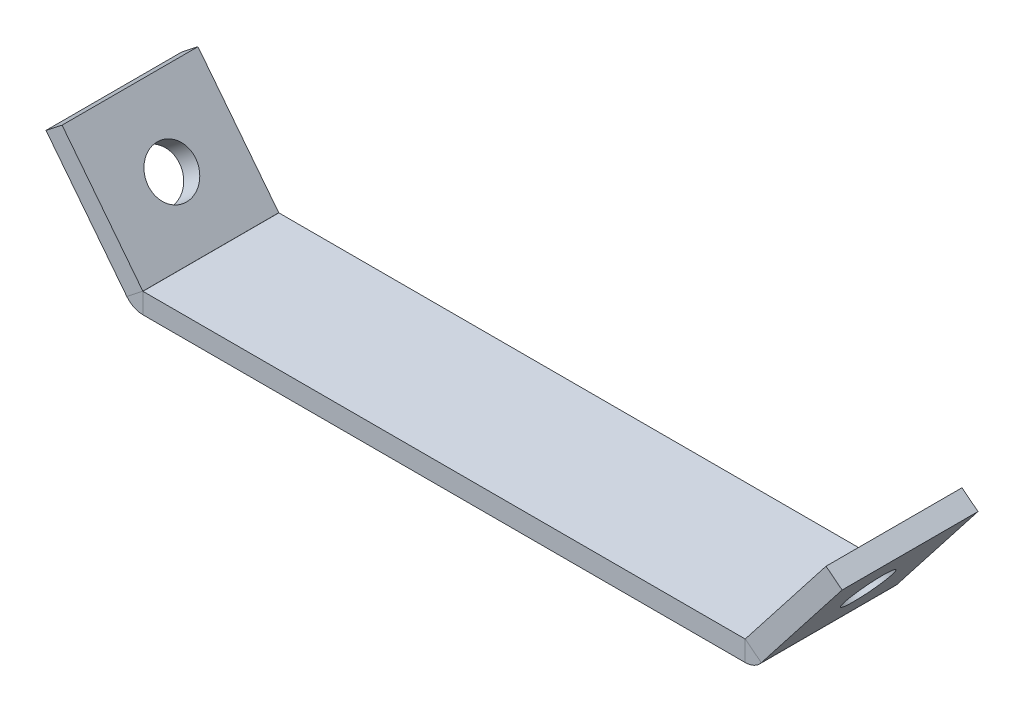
SolidWorks part; units mm, degrees
ref_plane "Front" through (0, 0, 0) normal (0, 0, 1) x (1, 0, 0)
ref_plane "Top" through (0, 0, 0) normal (0, 1, 0) x (1, 0, 0)
ref_plane "Right" through (0, 0, 0) normal (1, 0, 0) x (0, 0, -1)
sketch "Sketch1" plane through (0, 0, 0) normal (0, 1, 0) x (1, 0, 0)
  line L1 (0, 0) -> (65, 0)
  line L2 (0, 0) -> (0, 10)
  line L3 (0, 10) -> (65, 10)
  line L4 (65, 0) -> (65, 10)
  circle A0 centre (60, 5) radius 1.75
  circle A1 centre (5, 5) radius 1.75
sheet metal parameters "Sheet-Metal2" thickness 1.5 parameters "D1"=0.01
base flange "Base-Flange2" sketch "Sketch1" thickness 1.5 reverse thickness direction yes parameters "D1"=0.01
sketch "Sketch4" plane through (0, 1.5, 0) normal (0, 1, 0) x (-1, 0, 0)
  line L2 (-10, 0) -> (-10, -10)
  line L3 (-55, 0) -> (-55, -10)
sketched bend "Sketched Bend1" parameters "D1"=0
bend "SketchBend1" bend radius 0.01 bend angle 52 parameters "D5"=1
bend "SketchBend2" bend radius 0 bend angle 52 parameters "D5"=2
flat pattern "Flat-Pattern2"
sketch "Bend-Lines2" plane through (0, 1.5, 0) normal (0, 1, 0) x (-1, 0, 0)
  line L0 (-55, 0) -> (-55, -10) construction
  line L1 (-10, 0) -> (-10, -10) construction
bend of the flat pattern "Flatten-<SketchBend1>1"
bend of the flat pattern "Flatten-<SketchBend2>1"
